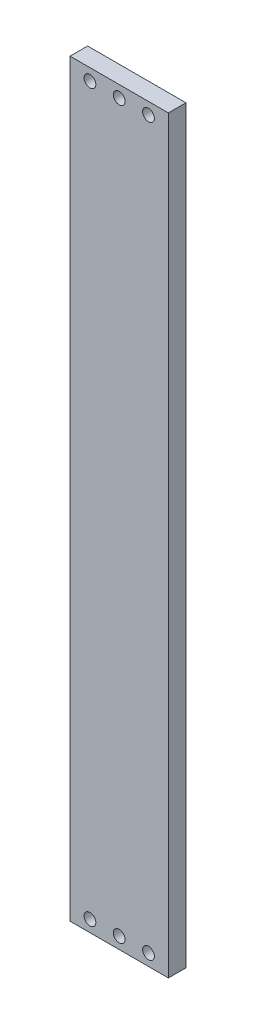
SolidWorks part; units mm, degrees
ref_plane "Front Plane" through (0, 0, 0) normal (0, 0, 1) x (1, 0, 0)
ref_plane "Top Plane" through (0, 0, 0) normal (0, 1, 0) x (1, 0, 0)
ref_plane "Right Plane" through (0, 0, 0) normal (1, 0, 0) x (0, 0, -1)
sketch "Sketch1" plane through (0, 0, 0) normal (0, 0, 1) x (1, 0, 0)
  line L0 (-8.4002, 1) -> (-1, 1)
  line L7 (-6.4003, -1) -> (6.4003, -1)
  line L8 (1, 1) -> (8.4003, 1)
  line L9 (-8.4002, -3) -> (-1, -3)
  line L10 (1, -3) -> (8.4003, -3)
  line L11 (-8.4002, -7) -> (-1, -7)
  line L12 (1, -7) -> (8.4003, -7)
  line L13 (-8.4002, -11) -> (-1, -11)
  line L14 (1, -11) -> (8.4003, -11)
  line L15 (-8.4002, -15) -> (-1, -15)
  line L16 (1, -15) -> (8.4003, -15)
  line L17 (-8.4002, -19) -> (-1, -19)
  line L18 (1, -19) -> (8.4003, -19)
  line L19 (-8.4002, -23) -> (-1, -23)
  line L20 (1, -23) -> (8.4003, -23)
  line L21 (-8.4002, -27) -> (-1, -27)
  line L22 (1, -27) -> (8.4003, -27)
  line L23 (-8.4002, -31) -> (-1, -31)
  line L24 (1, -31) -> (8.4003, -31)
  line L25 (-8.4002, -35) -> (-1, -35)
  line L26 (1, -35) -> (8.4003, -35)
  line L27 (-8.4002, -39) -> (-1, -39)
  line L28 (1, -39) -> (8.4003, -39)
  line L29 (-8.4002, -43) -> (-1, -43)
  line L30 (1, -43) -> (8.4003, -43)
  line L31 (-8.4002, -47) -> (-1, -47)
  line L32 (1, -47) -> (8.4003, -47)
  line L33 (-8.4002, -51) -> (-1, -51)
  line L34 (1, -51) -> (8.4003, -51)
  line L35 (-8.4002, -55) -> (-1, -55)
  line L36 (1, -55) -> (8.4003, -55)
  line L37 (-6.4002, -5) -> (6.4003, -5)
  line L38 (-6.4002, -9) -> (6.4003, -9)
  line L39 (-6.4002, -13) -> (6.4003, -13)
  line L40 (-6.4002, -17) -> (6.4003, -17)
  line L41 (-6.4002, -21) -> (6.4003, -21)
  line L42 (-6.4002, -25) -> (6.4003, -25)
  line L43 (-6.4002, -29) -> (6.4003, -29)
  line L44 (-6.4002, -33) -> (6.4003, -33)
  line L45 (-6.4002, -37) -> (6.4003, -37)
  line L46 (-6.4002, -41) -> (6.4003, -41)
  line L47 (-6.4002, -45) -> (6.4003, -45)
  line L48 (-6.4002, -49) -> (6.4003, -49)
  line L49 (-6.4002, -53) -> (6.4003, -53)
  line L50 (-8.4002, -59) -> (-1, -59)
  line L51 (1, -59) -> (8.4003, -59)
  line L52 (-6.4002, -57) -> (6.4003, -57)
  line L53 (-8.4002, -63) -> (-1, -63)
  line L54 (1, -63) -> (8.4003, -63)
  line L55 (-8.4002, -67) -> (-1, -67)
  line L56 (1, -67) -> (8.4003, -67)
  line L57 (-8.4002, -71) -> (-1, -71)
  line L58 (1, -71) -> (8.4003, -71)
  line L59 (-8.4002, -75) -> (-1, -75)
  line L60 (1, -75) -> (8.4003, -75)
  line L61 (-8.4002, -79) -> (-1, -79)
  line L62 (1, -79) -> (8.4003, -79)
  line L63 (-8.4002, -83) -> (-1, -83)
  line L64 (1, -83) -> (8.4003, -83)
  line L65 (-8.4002, -87) -> (-1, -87)
  line L66 (1, -87) -> (8.4003, -87)
  line L67 (-8.4002, -91) -> (-1, -91)
  line L68 (1, -91) -> (8.4003, -91)
  line L69 (-8.4002, -95) -> (-1, -95)
  line L70 (1, -95) -> (8.4003, -95)
  line L71 (-8.4002, -99) -> (-1, -99)
  line L72 (1, -99) -> (8.4003, -99)
  line L73 (-8.4002, -103) -> (-1, -103)
  line L74 (1, -103) -> (8.4003, -103)
  line L75 (-8.4002, -107) -> (-1, -107)
  line L76 (1, -107) -> (8.4003, -107)
  line L77 (-8.4002, -111) -> (-1, -111)
  line L78 (1, -111) -> (8.4003, -111)
  line L79 (-8.4002, -115) -> (-1, -115)
  line L80 (1, -115) -> (8.4003, -115)
  line L81 (-8.4002, -119) -> (-1, -119)
  line L82 (1, -119) -> (8.4003, -119)
  line L83 (-6.4002, -61) -> (6.4003, -61)
  line L84 (-6.4002, -65) -> (6.4003, -65)
  line L85 (-6.4002, -69) -> (6.4003, -69)
  line L86 (-6.4002, -73) -> (6.4003, -73)
  line L87 (-6.4002, -77) -> (6.4003, -77)
  line L88 (-6.4002, -81) -> (6.4003, -81)
  line L89 (-6.4002, -85) -> (6.4003, -85)
  line L90 (-6.4002, -89) -> (6.4003, -89)
  line L91 (-6.4002, -93) -> (6.4003, -93)
  line L92 (-6.4002, -97) -> (6.4003, -97)
  line L93 (-6.4002, -101) -> (6.4003, -101)
  line L94 (-6.4002, -105) -> (6.4003, -105)
  line L95 (-6.4002, -109) -> (6.4003, -109)
  line L96 (-6.4002, -113) -> (6.4003, -113)
  line L97 (-6.4002, -117) -> (6.4003, -117)
  point P0 (0, 0)
sketch "Croquis1" plane through (0, 0, 0) normal (0, 0, 1) x (1, 0, 0)
  line L0 (1, 1) -> (8.4003, 1) construction
  line L1 (-8.4002, 5) -> (8.4002, 5)
  line L2 (-8.4002, 5) -> (-8.4002, -123)
  line L3 (-8.4002, -123) -> (8.4002, -123)
  line L4 (8.4002, 5) -> (8.4002, -123)
  line L5 (8.4003, -59) -> (-8.4002, -59) construction
  circle A1 centre (0, -121) radius 1
  circle A2 centre (5, -121) radius 1
  circle A3 centre (-5, -121) radius 1
  circle A4 centre (5, 3) radius 1
  circle A5 centre (0, 3) radius 1
  circle A6 centre (-5, 3) radius 1
  point P4 (0, 5)
  point P8 (4.7001, 1)
extrude "Saliente-Extruir2" add sketch "Croquis1" along normal blind 3
equation "\"T\"= 2'Material thickness (mm)"
equation "\"k\"= 0.2'kerf mm"
equation "\"theta\"= 180'Total bend angle DEG"
equation "\"theta_rad\"= 3.14159 * \"theta\" / 180'Total bend angle RAD"
equation "\"n\"= round ( ( \"theta_rad\" / ( 3.14159 / 4 - arccos ( ( \"k\" + \"T\" ) / ( 2 * sqr ( ( \"T\" ^ 2 ) / 2 ) ) ) ) ) * 2 )'Minimum number of columns of torsional links"
equation "\"tallow\"= 20'Torsional Stress Allowed MPA"
equation "\"G\"= 1500'Torsional Modulus of the material (Pa)"
equation "\"l\"= 0.676125 * ( \"theta_rad\" * \"G\" * \"T\" ) / ( \"tallow\" * \"n\" )"
equation "\"D1@Sketch1\"=\"T\""
equation "\"D2@Sketch1\"=\"l\""
equation "\"D3@Sketch1\"=\"l\""
equation "\"D4@Sketch1\"=\"T\""
equation "\"D7@Sketch1\"=\"n\"/2 + 1"
equation "\"D9@Sketch1\"=\"n\"/2"
equation "\"D11@Sketch1\"=\"T\"*2"
equation "\"D10@Sketch1\"=\"T\"*2"
equation "\"distancia_rectangulo\"= 16.8005'Ancho del rectangulo"
equation "\"D1@Croquis1\"=\"distancia_rectangulo\""
equation "\"largo_rectangulo\"= \"T\" * \"n\" + 10'altura total del rectangulo"
equation "\"D2@Croquis1\"=\"largo_rectangulo\""
